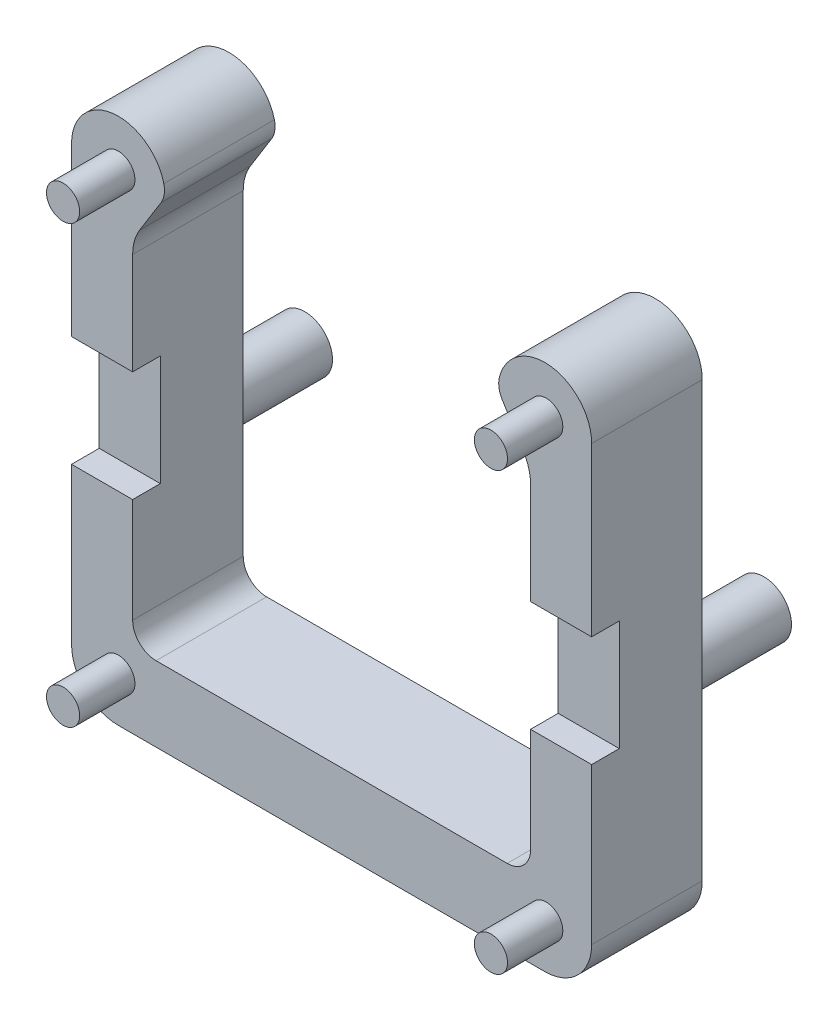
SolidWorks part; units mm, degrees
ref_plane "Plan de face" through (0, 0, 0) normal (0, 0, 1) x (1, 0, 0)
ref_plane "Plan de dessus" through (0, 0, 0) normal (0, 1, 0) x (1, 0, 0)
ref_plane "Plan de droite" through (0, 0, 0) normal (1, 0, 0) x (0, 0, -1)
sketch "Esquisse1" plane through (0, 0, 0) normal (0, 0, 1) x (1, 0, 0)
  circle A0 centre (0, 0) radius 0.9
  circle A1 centre (23.215, 0) radius 0.9
  circle A2 centre (0, -23.68) radius 0.9
  circle A3 centre (23.215, -23.68) radius 0.9
  dimension "D1" = 23.215
  dimension "D2" = 23.68
  dimension "D3" = 23.68
  dimension "D5" = 1.8
  dimension "D6" = 1.8
  dimension "D7" = 1.8
  dimension "D8" = 1.8
  dimension "D4" = 23.215
sketch "Esquisse2" plane through (0, 0, 0) normal (0, 0, 1) x (1, 0, 0)
  line L0 (-2.54, 0) -> (-2.54, -23.5458)
  line L1 (0, -26.0858) -> (23.1394, -26.0858)
  line L2 (25.6794, -23.5458) -> (25.6794, 0)
  line L3 (21.0947, -22.0218) -> (2.0447, -22.0218)
  line L4 (0.7747, -20.7518) -> (0.7747, -3.5688)
  line L5 (1.1565, -2.2296) -> (2.3125, -0.3667)
  line L6 (22.3647, -20.7518) -> (22.3647, -3.5688)
  line L7 (21.9829, -2.2296) -> (20.8269, -0.3667)
  arc A0 (2.4667, 0.6059) -> (-2.54, 0) centre (0, 0) ccw
  arc A1 (-2.54, -23.5458) -> (0, -26.0858) centre (0, -23.5458) ccw
  arc A2 (23.1394, -26.0858) -> (25.6794, -23.5458) centre (23.1394, -23.5458) ccw
  arc A3 (1.1565, -2.2296) -> (0.7747, -3.5688) centre (3.3147, -3.5688) ccw
  arc A4 (2.3125, -0.3667) -> (2.4667, 0.6059) centre (1.2333, 0.3029) ccw
  arc A5 (25.6794, 0) -> (20.6727, 0.6059) centre (23.1394, 0) ccw
  arc A6 (20.6727, 0.6059) -> (20.8269, -0.3667) centre (21.9061, 0.3029) ccw
  arc A7 (22.3647, -3.5688) -> (21.9829, -2.2296) centre (19.8247, -3.5688) ccw
  arc A8 (0.7747, -20.7518) -> (2.0447, -22.0218) centre (2.0447, -20.7518) ccw
  arc A9 (21.0947, -22.0218) -> (22.3647, -20.7518) centre (21.0947, -20.7518) ccw
extrude "Boss.-Extru.1" add sketch "Esquisse2" against normal blind 6
extrude "Boss.-Extru.2" add sketch "Esquisse1" along normal blind 3
sketch "Esquisse3" plane through (0, 0, -6) normal (0, 0, -1) x (-1, 0, 0)
  line L1 (0, -26.0858) -> (-23.1394, -26.0858) construction
  circle A1 centre (-24.022, -14.0858) radius 1.5
  circle A2 centre (0.8827, -14.0858) radius 1.5
  dimension "D1" = 12
  dimension "D2" = 12
extrude "Boss.-Extru.3" add sketch "Esquisse3" along normal blind 5
sketch "Esquisse4" plane through (-2.54, 0, 0) normal (-1, 0, 0) x (0, 0, 1)
  line L0 (0, 0) -> (0, -23.5458) construction
  line L1 (0, -9.0858) -> (-1.5, -9.0858)
  line L2 (0, -9.0858) -> (0, -15.0858)
  line L3 (0, -15.0858) -> (-1.5, -15.0858)
  line L4 (-1.5, -9.0858) -> (-1.5, -15.0858)
  line L5 (-6, -26.0858) -> (0, -26.0858) construction
  point P6 (-0.75, -9.0858)
  dimension "D1" = 6
  dimension "D2" = 1.5
  dimension "D3" = 17
extrude "Enlèv. mat.-Extru.1" cut sketch "Esquisse4" against normal through all
